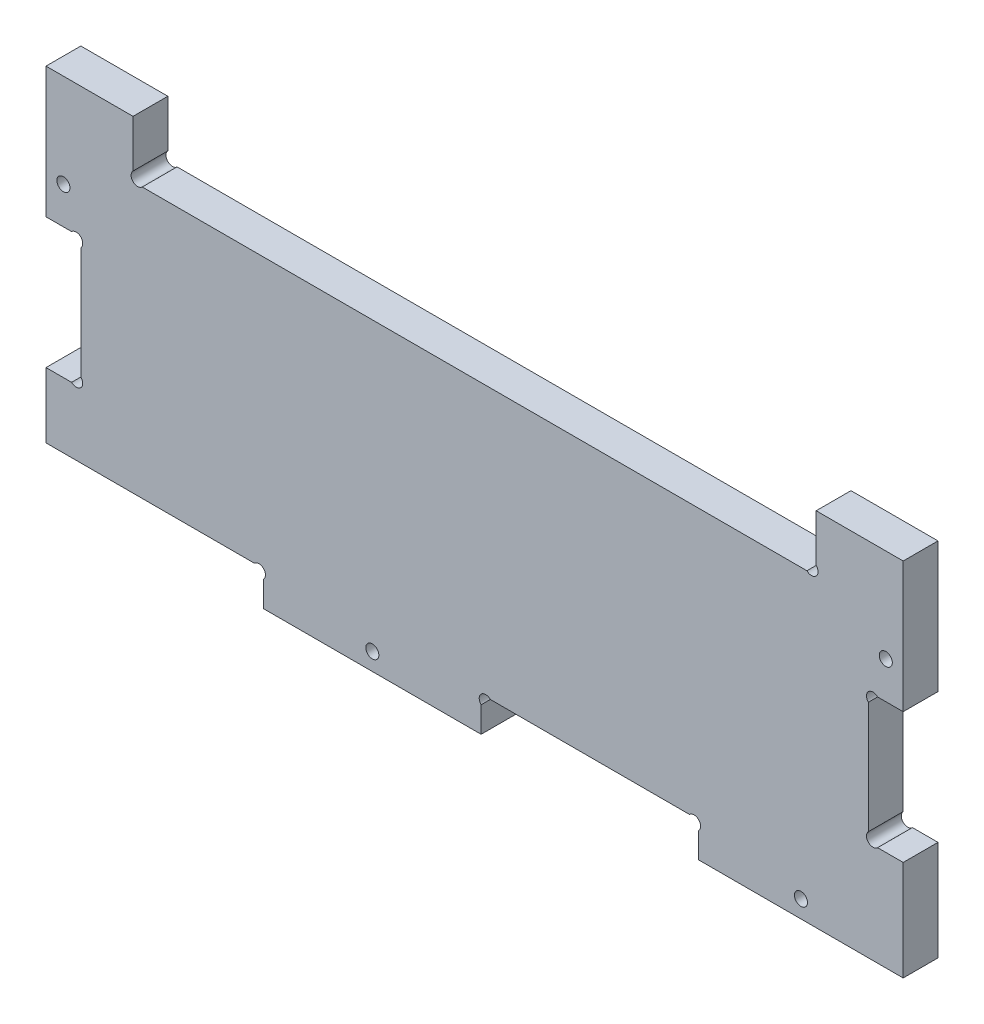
SolidWorks part; units mm, degrees
ref_plane "Plan de face" through (0, 0, 0) normal (0, 0, 1) x (1, 0, 0)
ref_plane "Plan de dessus" through (0, 0, 0) normal (0, 1, 0) x (1, 0, 0)
ref_plane "Plan de droite" through (0, 0, 0) normal (1, 0, 0) x (0, 0, -1)
sketch "Esquisse1" plane through (0, 0, 0) normal (0, 0, 1) x (1, 0, 0)
  line L0 (-173.8157, 28.3831) -> (-173.8157, 45.3831)
  line L1 (23.1843, 45.3831) -> (23.1843, 58.3831)
  line L2 (-173.8157, -16.6169) -> (-173.8157, -1.6169)
  line L3 (23.1843, -24.6169) -> (23.1843, -1.6169)
  line L4 (23.1843, 28.3831) -> (17.3056, 28.3831)
  line L5 (15.1843, 26.2618) -> (15.1843, 0.5044)
  line L6 (17.3056, -1.6169) -> (23.1843, -1.6169)
  line L7 (23.1843, 28.3831) -> (23.1843, 45.3831)
  line L8 (-173.8157, 45.3831) -> (-173.8157, 58.3831)
  line L9 (-173.8157, 58.3831) -> (-153.8157, 58.3831)
  line L10 (-123.8157, -24.6169) -> (-73.8157, -16.6169) construction
  line L11 (23.1843, 58.3831) -> (3.1843, 58.3831)
  line L12 (23.1843, -24.6169) -> (-23.8157, -24.6169)
  line L13 (-23.8157, -24.6169) -> (-23.8157, -18.7382)
  line L14 (-71.6944, -16.6169) -> (-25.937, -16.6169)
  line L15 (-23.8157, -24.6169) -> (23.1843, -16.6169) construction
  line L16 (-73.8157, -18.7382) -> (-73.8157, -24.6169)
  line L17 (-73.8157, -24.6169) -> (-123.8157, -24.6169)
  line L18 (-123.8157, -24.6169) -> (-123.8157, -18.7382)
  line L19 (-125.937, -16.6169) -> (-173.8157, -16.6169)
  line L20 (15.1843, 28.3831) -> (19.7803, 23.7871) construction
  line L21 (-153.8157, 58.3831) -> (-153.8157, 47.5044)
  line L22 (15.1843, -1.6169) -> (21.5757, 4.7744) construction
  line L23 (-151.6944, 45.3831) -> (1.063, 45.3831)
  line L24 (-153.8157, 45.3831) -> (-141.9943, 57.2045) construction
  line L25 (-173.8157, -1.6169) -> (-167.937, -1.6169)
  line L26 (3.1843, 45.3831) -> (-16.455, 65.0224) construction
  line L27 (-165.8157, 0.5044) -> (-165.8157, 26.2618)
  line L28 (-167.937, 28.3831) -> (-173.8157, 28.3831)
  line L29 (3.1843, 58.3831) -> (3.1843, 47.5044)
  line L30 (-173.8157, 45.3831) -> (-165.8157, 28.3831) construction
  line L31 (15.1843, 28.3831) -> (23.1843, 45.3831) construction
  arc A0 (17.3056, 28.3831) -> (15.1843, 26.2618) centre (16.245, 27.3225) ccw
  arc A1 (-123.8157, -18.7382) -> (-125.937, -16.6169) centre (-124.8763, -17.6775) ccw
  arc A2 (-71.6944, -16.6169) -> (-73.8157, -18.7382) centre (-72.755, -17.6775) ccw
  arc A3 (-23.8157, -18.7382) -> (-25.937, -16.6169) centre (-24.8763, -17.6775) ccw
  arc A4 (-153.8157, 47.5044) -> (-151.6944, 45.3831) centre (-152.755, 46.4438) ccw
  arc A5 (-167.937, -1.6169) -> (-165.8157, 0.5044) centre (-166.8763, -0.5562) ccw
  arc A6 (-165.8157, 26.2618) -> (-167.937, 28.3831) centre (-166.8763, 27.3225) ccw
  arc A7 (15.1843, 0.5044) -> (17.3056, -1.6169) centre (16.245, -0.5562) ccw
  arc A8 (1.063, 45.3831) -> (3.1843, 47.5044) centre (2.1237, 46.4438) ccw
  circle A9 centre (-98.8157, -20.6169) radius 1.5
  circle A10 centre (-0.3157, -20.6169) radius 1.5
  circle A11 centre (19.1843, 36.8831) radius 1.5
  circle A12 centre (-169.8157, 36.8831) radius 1.5
  dimension "D1" = 50
  dimension "D8" = 45
  dimension "D2" = 20
  dimension "D6" = 45
  dimension "D9" = 50
  dimension "D3" = 45
  dimension "D4" = 45
  dimension "D7" = 50
  dimension "D11" = 47
  dimension "D12" = 20
extrude "Boss.-Extru.1" add sketch "Esquisse1" along normal blind 8
